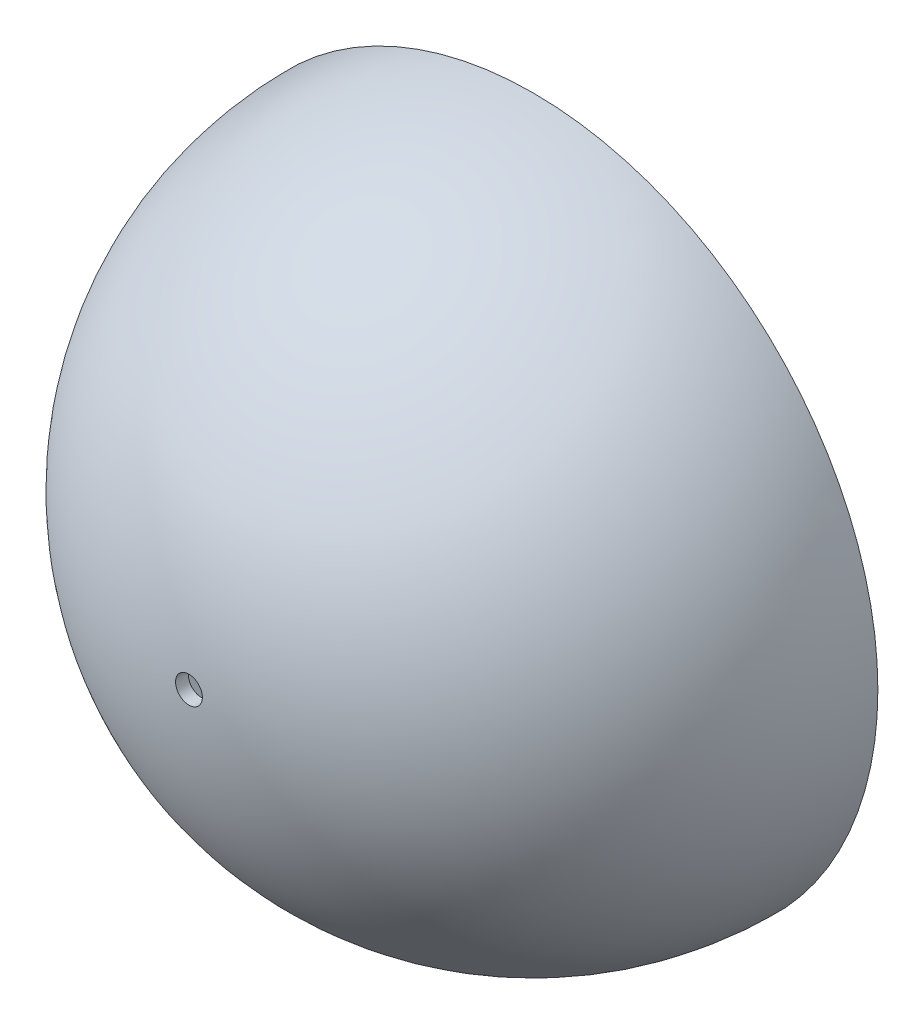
SolidWorks part; units mm, degrees
ref_plane "Front Plane" through (0, 0, 0) normal (0, 0, 1) x (1, 0, 0)
ref_plane "Top Plane" through (0, 0, 0) normal (0, 1, 0) x (1, 0, 0)
ref_plane "Right Plane" through (0, 0, 0) normal (1, 0, 0) x (0, 0, -1)
sketch "Sketch1" plane through (0, 0, 0) normal (0, 0, 1) x (1, 0, 0)
  line L0 (-54, 0) -> (54, 0)
  arc A0 (-54, 0) -> (54, 0) centre (0, 0) cw
  dimension "D1" = 108
revolve "Revolve1" add sketch "Sketch1" angle 180 about L0
shell "Shell1" thickness 2
sketch "Sketch2" plane through (0, 0, 0) normal (0, 0, -1) x (-1, 0, 0)
  circle A0 centre (0, 0) radius 2.1
  dimension "D1" = 4.2
extrude "Extrude1" cut sketch "Sketch2" against normal through all
